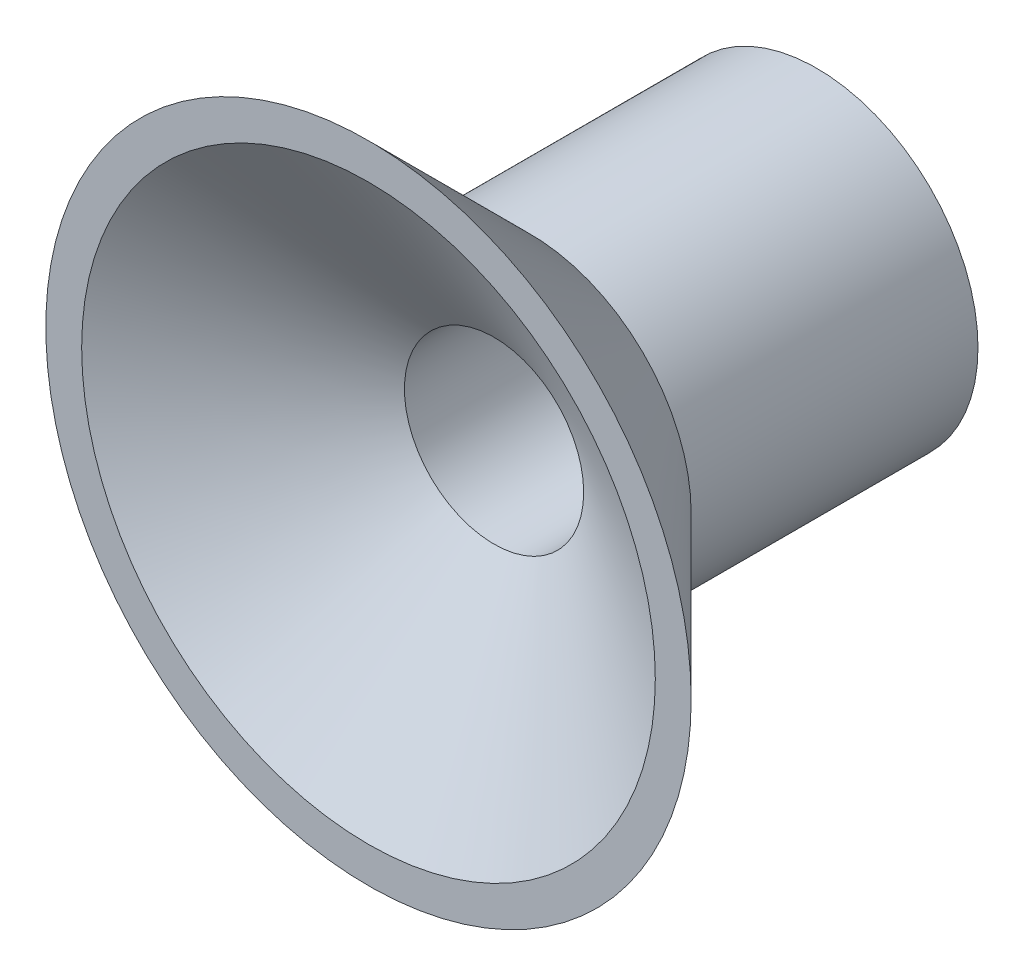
SolidWorks part; units mm, degrees
ref_plane "前视基准面" through (0, 0, 0) normal (0, 0, 1) x (1, 0, 0)
ref_plane "上视基准面" through (0, 0, 0) normal (0, 1, 0) x (1, 0, 0)
ref_plane "右视基准面" through (0, 0, 0) normal (1, 0, 0) x (0, 0, -1)
sketch "草图1" plane through (0, 0, 0) normal (0, 1, 0) x (1, 0, 0)
  line L0 (0, 0) -> (0, 42.6689) construction
  line L1 (-2.5, 12.5) -> (-2.5, 3.5023)
  line L2 (-8, 0) -> (-9, 0)
  line L4 (-2.5, 12.5) -> (-4.5, 12.5)
  line L5 (-2.5, 3.5023) -> (-8, 0)
  line L7 (-4.5, 12.5) -> (-4.5, 4.5)
  line L8 (-4.5, 4.5) -> (-9, 0)
  dimension "D1" = 8
  dimension "D2" = 1
  dimension "D3" = 2
  dimension "D4" = 2.5
revolve "旋转1" add sketch "草图1" angle 360 about L0
